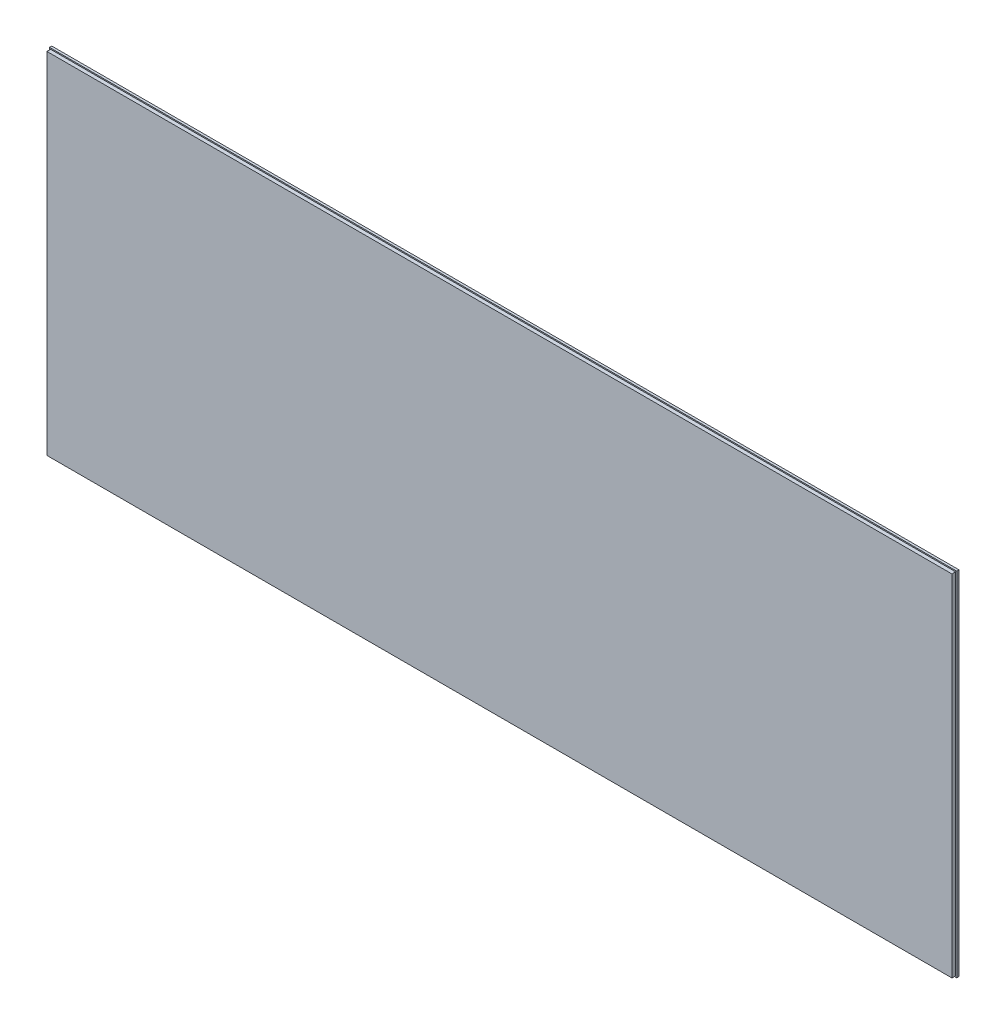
SolidWorks part; units mm, degrees
ref_plane "Ebene vorne" through (0, 0, 0) normal (0, 0, 1) x (1, 0, 0)
ref_plane "Ebene oben" through (0, 0, 0) normal (0, 1, 0) x (1, 0, 0)
ref_plane "Ebene rechts" through (0, 0, 0) normal (1, 0, 0) x (0, 0, -1)
sketch "Skizze1" plane through (0, 0, 0) normal (0, 0, 1) x (1, 0, 0)
  line L1 (-988, -383.5) -> (988, -383.5)
  line L2 (-988, -383.5) -> (-988, 383.5)
  line L3 (-988, 383.5) -> (988, 383.5)
  line L4 (988, -383.5) -> (988, 383.5)
  line L5 (-988, -383.5) -> (988, 383.5) construction
  line L6 (-988, 383.5) -> (988, -383.5) construction
  point P0 (0, 0)
  dimension "D1" = 1976
  dimension "D2" = 767
extrude "Aufsatz-Linear austragen1" add sketch "Skizze1" along normal blind 13
sketch "Skizze6" plane through (-988, 0, 0) normal (-1, 0, 0) x (0, 0, 1)
  line L0 (5, 383.5) -> (5, 381)
  line L2 (13, 383.5) -> (0, 383.5) construction
  line L4 (5, 381) -> (13, 381)
  line L5 (13, 383.5) -> (13, -383.5) construction
  line L6 (13, 381) -> (13, 383.5)
  line L7 (13, 383.5) -> (5, 383.5)
  dimension "D1" = 8
  dimension "D2" = 2.5
extrude "Schnitt-Linear austragen1" cut sketch "Skizze6" against normal through all
ref_plane "Ebene1" [suppressed] through (0, 0, 0) normal (0, 1, 0) x (1, 0, 0)
mirror "Spiegeln1" about plane through (0, 0, 0) normal (0, 1, 0) of "Schnitt-Linear austragen1"
sketch "Skizze7" plane through (0, -381, 0) normal (0, -1, 0) x (1, 0, 0)
  line L0 (-988, 13) -> (-985.5, 13)
  line L1 (988, 13) -> (-988, 13) construction
  line L2 (-985.5, 13) -> (-985.5, 5)
  line L3 (988, 5) -> (-988, 5) construction
  line L4 (-985.5, 5) -> (-988, 5)
  line L5 (-988, 5) -> (-988, 13)
  dimension "D1" = 2.5
extrude "Schnitt-Linear austragen2" cut sketch "Skizze7" against normal through all
ref_plane "Ebene2" [suppressed] through (0, 0, 0) normal (1, 0, 0) x (0, 0, -1)
mirror "Spiegeln2" about plane through (0, 0, 0) normal (1, 0, 0) of "Schnitt-Linear austragen2"
